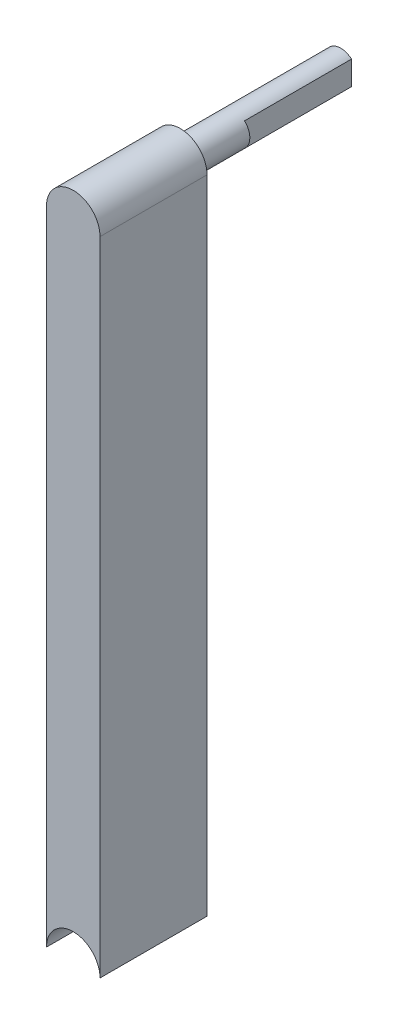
SolidWorks part; units mm, degrees
ref_plane "Plan1" through (0, 0, 0) normal (0, 0, 1) x (1, 0, 0)
ref_plane "Plan2" through (0, 0, 0) normal (0, 1, 0) x (1, 0, 0)
ref_plane "Plan3" through (0, 0, 0) normal (1, 0, 0) x (0, 0, -1)
sketch "Esquisse1" plane through (0, 0, 0) normal (0, 0, 1) x (1, 0, 0)
  line L0 (5, 120) -> (5, 0)
  line L1 (-5, 120) -> (-5, 0)
  arc A0 (5, 120) -> (-5, 120) centre (0, 120) ccw
  arc A1 (5, 0) -> (-5, 0) centre (0, 0) ccw
  dimension "D1" = 10
  dimension "D2" = 120
extrude "Base-Extrusion" add sketch "Esquisse1" along normal blind 20
ref_plane "Plan5" through (16.0373, 117.817, 0) normal (0.1349, 0.9909, 0) x (-0.9909, 0.1349, 0)
sketch "Esquisse2" plane through (16.0373, 117.817, 0) normal (0.1349, 0.9909, 0) x (-0.9909, 0.1349, 0)
  line L0 (16.1852, 40.7812) -> (16.1852, -45.7345) construction
  line L2 (19.1852, 0) -> (19.1852, -30)
  line L3 (11.2308, 0) -> (21.1852, 0) construction
  line L4 (16.1852, 20) -> (16.1852, 0) construction
  line L5 (19.1852, -30) -> (16.1852, -30)
  line L6 (19.1852, 0) -> (16.1852, 0)
  line L8 (16.1852, -30) -> (16.1852, 0)
  dimension "D1" = 30
  dimension "D2" = 3
revolve "Boss.-Révol.1" add sketch "Esquisse2" angle 360 about L0
sketch "Esquisse4" plane through (0, 0, -30) normal (0, 0, -1) x (-1, 0, 0)
  line L1 (2, 110.2127) -> (2, 129.7487)
  line L3 (-2, 129.8065) -> (-2, 110.1549)
  line L6 (33.5059, 124.5608) -> (-65.5804, 111.0732) construction
  circle A3 centre (0, 120) radius 3 construction
  arc A4 (2, 110.2127) -> (2, 129.7487) centre (-0.1415, 119.9807) ccw
  arc A5 (-2, 129.8065) -> (-2, 110.1549) centre (-0.1415, 119.9807) ccw
  dimension "D1" = 4
  dimension "D2" = 2
  dimension "D3" = 20
extrude "Enlèv. mat.-Extru.1" cut sketch "Esquisse4" against normal blind 20
